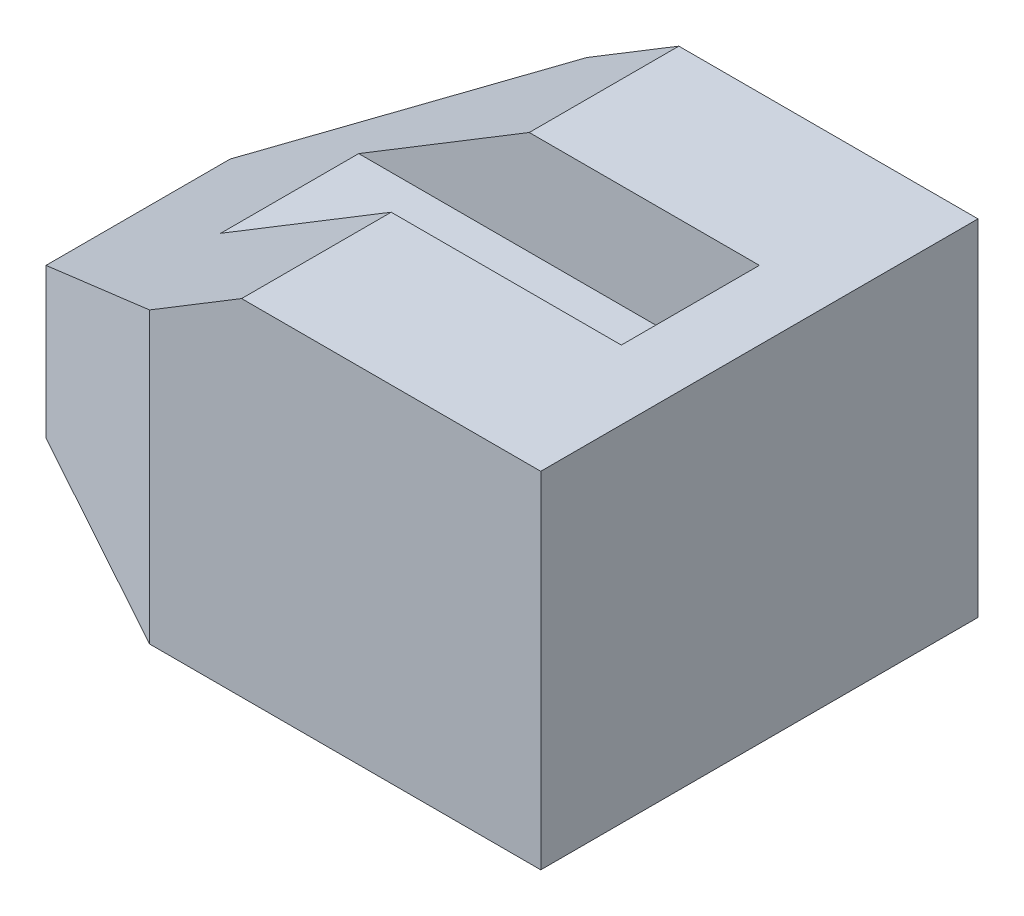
SolidWorks part; units mm, degrees
ref_plane "前视基准面" through (0, 0, 0) normal (0, 0, 1) x (1, 0, 0)
ref_plane "上视基准面" through (0, 0, 0) normal (0, 1, 0) x (1, 0, 0)
ref_plane "右视基准面" through (0, 0, 0) normal (1, 0, 0) x (0, 0, -1)
sketch "草图1" plane through (0, 0, 0) normal (0, 0, 1) x (1, 0, 0)
  line L0 (0, 0) -> (54, 0)
  line L1 (54, 0) -> (54, 30)
  line L2 (54, 30) -> (28, 30)
  line L3 (28, 30) -> (0, 13)
  line L4 (0, 13) -> (0, 0)
  dimension "D1" = 54
  dimension "D2" = 30
  dimension "D3" = 26
  dimension "D4" = 13
extrude "拉伸1" add sketch "草图1" along normal mid plane 38
sketch "草图2" plane through (0, 0, 0) normal (0, -1, 0) x (1, 0, 0)
  line L0 (20, 19) -> (0, 8)
  line L1 (0, 19) -> (54, 19) construction
  line L2 (0, 19) -> (0, -19) construction
  line L3 (0, 8) -> (0, 19)
  line L4 (0, 19) -> (20, 19)
extrude "切除-拉伸1" cut sketch "草图2" against normal blind 38
mirror "镜向1" about plane through (0, 0, 0) normal (0, 0, 1) of "切除-拉伸1"
sketch "草图4" plane through (0, 0, 0) normal (0, 0, 1) x (1, 0, 0)
  line L0 (48, 30) -> (40.5014, 21)
  line L1 (54, 30) -> (28, 30) construction
  line L2 (40.5014, 21) -> (13.1765, 21)
  line L3 (0, 13) -> (20, 25.1429) construction
  line L4 (13.1765, 21) -> (28, 30)
  line L5 (28, 30) -> (48, 30)
  line L6 (54, 0) -> (54, 30) construction
  dimension "D1" = 6
  dimension "D2" = 9
extrude "切除-拉伸2" cut sketch "草图4" against normal mid plane 12
